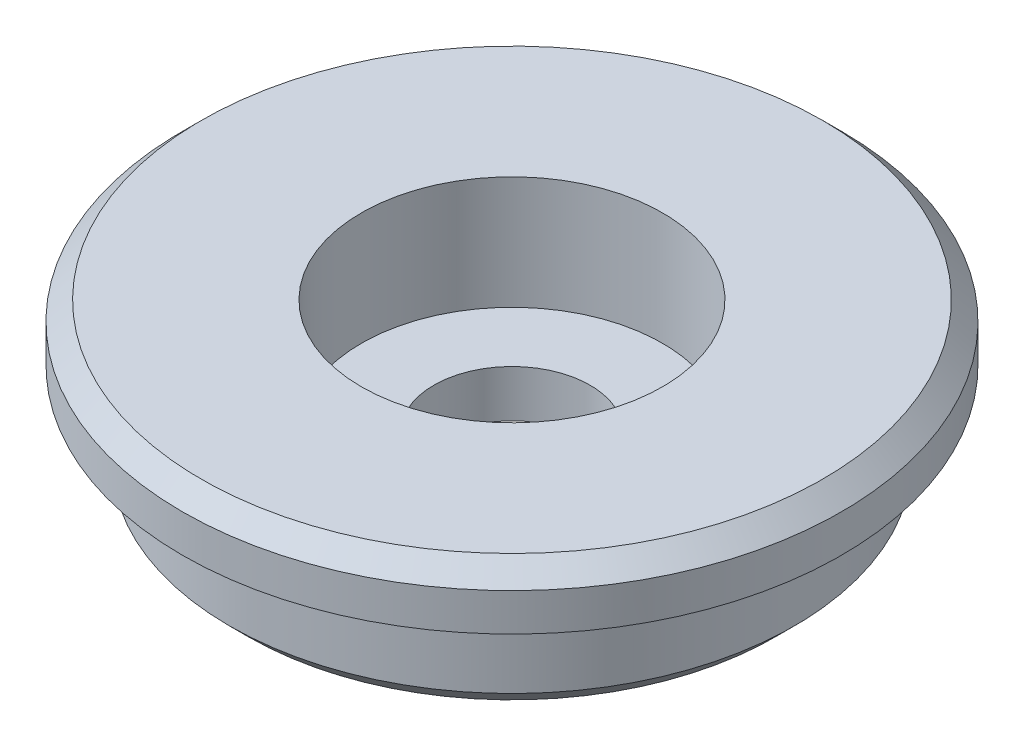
SolidWorks part; units mm, degrees
ref_plane "Face" through (0, 0, 0) normal (0, 0, 1) x (1, 0, 0)
ref_plane "Dessus" through (0, 0, 0) normal (0, 1, 0) x (1, 0, 0)
ref_plane "Droite" through (0, 0, 0) normal (1, 0, 0) x (0, 0, -1)
sketch "Esquisse1" plane through (0, 0, 0) normal (0, 0, 1) x (1, 0, 0)
  line L0 (0, 34.1446) -> (0, -45.461) construction
  line L2 (8, 2.5) -> (8, 8.5)
  line L4 (8, 8.5) -> (17.5, 8.5)
  line L6 (17.5, 8.5) -> (17.5, 5.5)
  line L8 (17.5, 5.5) -> (15, 5.5)
  line L10 (15, 5.5) -> (15, 0)
  line L12 (15, 0) -> (4.15, 0)
  line L13 (4.15, 2.5) -> (4.15, 0)
  line L16 (4.15, 2.5) -> (8, 2.5)
  dimension "D1" = 8.3
  dimension "D2" = 16
  dimension "D3" = 8.5
  dimension "D4" = 6
  dimension "D5" = 3
  dimension "D6" = 30
  dimension "D7" = 35
revolve "Révolution1" add sketch "Esquisse1" angle 360 about L0
fillet "Congé1" radius 0.5 1 edges at (0, 5.5, 15)
chamfer "Chanfrein1" distance 1 angle 45 2 edges at (0, 0, 15) (0, 8.5, 17.5)
